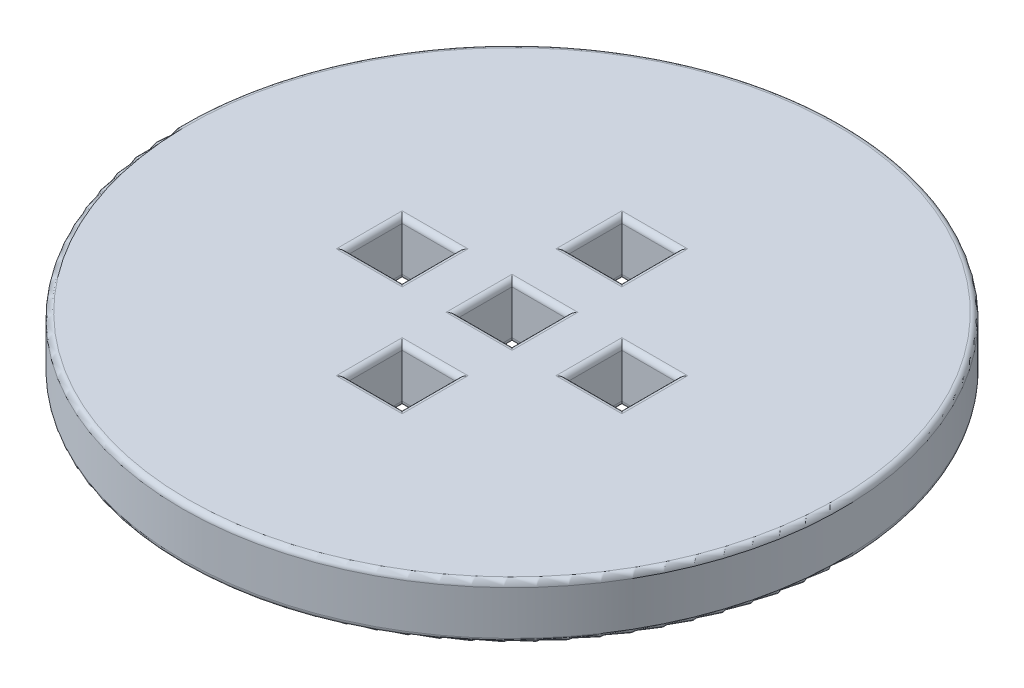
SolidWorks part; units mm, degrees
ref_plane "Front Plane" through (0, 0, 0) normal (0, 0, 1) x (1, 0, 0)
ref_plane "Top Plane" through (0, 0, 0) normal (0, 1, 0) x (1, 0, 0)
ref_plane "Right Plane" through (0, 0, 0) normal (1, 0, 0) x (0, 0, -1)
sketch "Sketch1" plane through (0, 0, 0) normal (0, 1, 0) x (1, 0, 0)
  circle A0 centre (0, 0) radius 30
extrude "Boss-Extrude1" add sketch "Sketch1" along normal blind 5
sketch "Sketch2" plane through (0, 5, 0) normal (0, 1, 0) x (1, 0, 0)
  line L0 (0, 0) -> (0, -10) construction
  line L1 (0, 0) -> (10, 0) construction
  line L2 (0, 0) -> (-10, 0) construction
  line L3 (0, 0) -> (0, 10) construction
  line L5 (-2.5, -7.5) -> (2.5, -7.5)
  line L6 (-2.5, -7.5) -> (-2.5, -12.5)
  line L7 (-2.5, -12.5) -> (2.5, -12.5)
  line L8 (2.5, -7.5) -> (2.5, -12.5)
  line L9 (-2.5, -7.5) -> (2.5, -12.5) construction
  line L10 (-2.5, -12.5) -> (2.5, -7.5) construction
  line L11 (-7.5, -2.5) -> (-12.5, -2.5)
  line L12 (-7.5, -2.5) -> (-7.5, 2.5)
  line L13 (-7.5, 2.5) -> (-12.5, 2.5)
  line L14 (-12.5, -2.5) -> (-12.5, 2.5)
  line L15 (-7.5, -2.5) -> (-12.5, 2.5) construction
  line L16 (-7.5, 2.5) -> (-12.5, -2.5) construction
  line L17 (2.5, -2.5) -> (-2.5, -2.5)
  line L18 (2.5, -2.5) -> (2.5, 2.5)
  line L19 (2.5, 2.5) -> (-2.5, 2.5)
  line L20 (-2.5, -2.5) -> (-2.5, 2.5)
  line L21 (2.5, -2.5) -> (-2.5, 2.5) construction
  line L22 (2.5, 2.5) -> (-2.5, -2.5) construction
  line L23 (-2.5, 12.5) -> (2.5, 12.5)
  line L24 (-2.5, 12.5) -> (-2.5, 7.5)
  line L25 (-2.5, 7.5) -> (2.5, 7.5)
  line L26 (2.5, 12.5) -> (2.5, 7.5)
  line L27 (-2.5, 12.5) -> (2.5, 7.5) construction
  line L28 (-2.5, 7.5) -> (2.5, 12.5) construction
  line L29 (12.5, -2.5) -> (7.5, -2.5)
  line L30 (12.5, -2.5) -> (12.5, 2.5)
  line L31 (12.5, 2.5) -> (7.5, 2.5)
  line L32 (7.5, -2.5) -> (7.5, 2.5)
  line L33 (12.5, -2.5) -> (7.5, 2.5) construction
  line L34 (12.5, 2.5) -> (7.5, -2.5) construction
  dimension "D1" = 5
  dimension "D2" = 10
  dimension "D3" = 5
  dimension "D4" = 5
  dimension "D5" = 5
  dimension "D6" = 5
  dimension "D7" = 5
  dimension "D8" = 5
extrude "Cut-Extrude1" cut sketch "Sketch2" against normal blind 2.5
fillet "Fillet1" radius 0.5 6 edges at (2.5, 5, 0) (0, 5, 2.5) (-12.5, 5, 0) (-10, 5, 2.5) (-7.5, 5, 0) (-10, 5, -2.5)
sketch "Sketch3" plane through (0, 5, 0) normal (0, 1, 0) x (1, 0, 0)
sketch "Sketch4" plane through (0, 0, 0) normal (0, -1, 0) x (-1, 0, 0)
  line L0 (0, 0) -> (-10, 0) construction
  line L1 (0, 0) -> (0, -10) construction
  line L2 (0, 0) -> (0, 10) construction
  line L3 (0, 0) -> (10, 0) construction
  line L5 (-2.5, 2.5) -> (2.5, 2.5)
  line L6 (-2.5, 2.5) -> (-2.5, -2.5)
  line L7 (-2.5, -2.5) -> (2.5, -2.5)
  line L8 (2.5, 2.5) -> (2.5, -2.5)
  line L9 (-2.5, 2.5) -> (2.5, -2.5) construction
  line L10 (-2.5, -2.5) -> (2.5, 2.5) construction
  line L11 (-2.5, -7.5) -> (2.5, -7.5)
  line L12 (-2.5, -7.5) -> (-2.5, -12.5)
  line L13 (-2.5, -12.5) -> (2.5, -12.5)
  line L14 (2.5, -7.5) -> (2.5, -12.5)
  line L15 (-2.5, -7.5) -> (2.5, -12.5) construction
  line L16 (-2.5, -12.5) -> (2.5, -7.5) construction
  line L17 (7.5, 2.5) -> (12.5, 2.5)
  line L18 (7.5, 2.5) -> (7.5, -2.5)
  line L19 (7.5, -2.5) -> (12.5, -2.5)
  line L20 (12.5, 2.5) -> (12.5, -2.5)
  line L21 (7.5, 2.5) -> (12.5, -2.5) construction
  line L22 (7.5, -2.5) -> (12.5, 2.5) construction
  line L23 (-12.5, 2.5) -> (-7.5, 2.5)
  line L24 (-12.5, 2.5) -> (-12.5, -2.5)
  line L25 (-12.5, -2.5) -> (-7.5, -2.5)
  line L26 (-7.5, 2.5) -> (-7.5, -2.5)
  line L27 (-12.5, 2.5) -> (-7.5, -2.5) construction
  line L28 (-12.5, -2.5) -> (-7.5, 2.5) construction
  line L29 (2.5, 7.5) -> (-2.5, 7.5)
  line L30 (2.5, 7.5) -> (2.5, 12.5)
  line L31 (2.5, 12.5) -> (-2.5, 12.5)
  line L32 (-2.5, 7.5) -> (-2.5, 12.5)
  line L33 (2.5, 7.5) -> (-2.5, 12.5) construction
  line L34 (2.5, 12.5) -> (-2.5, 7.5) construction
  dimension "D1" = 5
  dimension "D2" = 5
  dimension "D3" = 5
  dimension "D4" = 5
  dimension "D5" = 5
  dimension "D6" = 5
extrude "Cut-Extrude2" cut sketch "Sketch4" against normal blind 2.5
fillet "Fillet2" radius 0.5 21 edges at (0, 0, 30) (2.5, 0, 0) (0, 0, 2.5) (-2.5, 0, 0) (0, 0, -2.5) (2.5, 0, 10) (0, 0, 12.5) (-2.5, 0, 10) (0, 0, 7.5) (-7.5, 0, 0) (-10, 0, 2.5) (-12.5, 0, 0) (-10, 0, -2.5) (12.5, 0, 0) (10, 0, 2.5) (7.5, 0, 0) (10, 0, -2.5) (-2.5, 0, -10) (0, 0, -12.5) (2.5, 0, -10) (0, 0, -7.5)
fillet "Fillet3" radius 0.5 15 edges at (0, 5, 30) (0, 5, 7.5) (-2.5, 5, 10) (0, 5, 12.5) (2.5, 5, 10) (-2.5, 5, 0.25) (0.25, 5, -2.5) (0, 5, -12.5) (-2.5, 5, -10) (0, 5, -7.5) (2.5, 5, -10) (10, 5, 2.5) (12.5, 5, 0) (10, 5, -2.5) (7.5, 5, 0)
